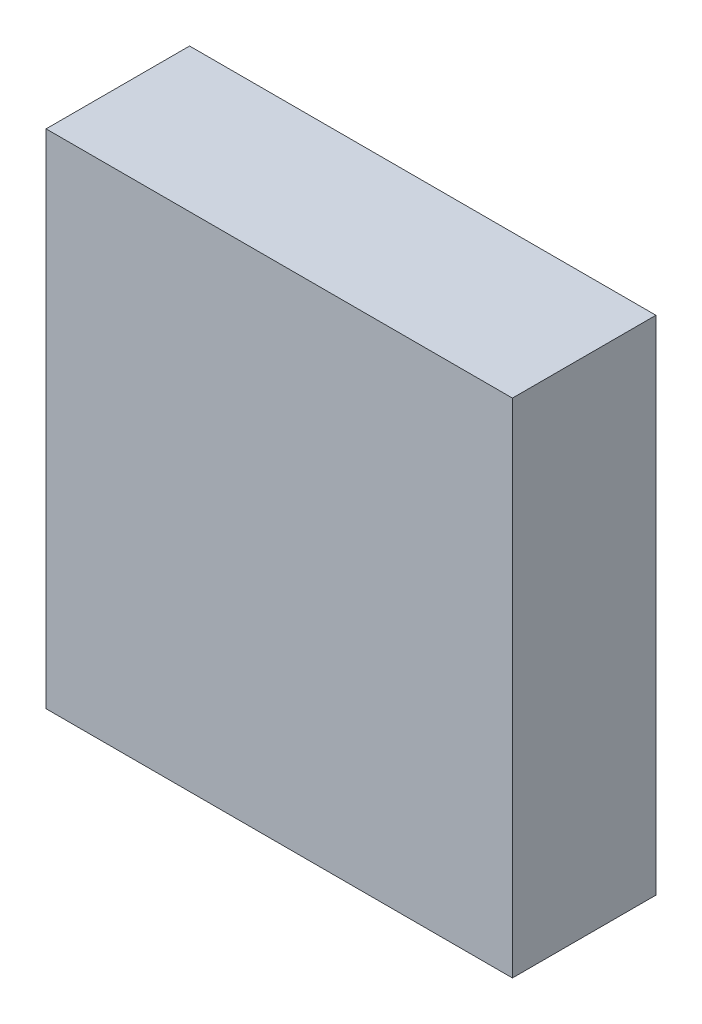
SolidWorks part; units mm, degrees
ref_plane "Ebene vorne" through (0, 0, 0) normal (0, 0, 1) x (1, 0, 0)
ref_plane "Ebene oben" through (0, 0, 0) normal (0, 1, 0) x (1, 0, 0)
ref_plane "Ebene rechts" through (0, 0, 0) normal (1, 0, 0) x (0, 0, -1)
sketch "Skizze1" plane through (0, 0, 0) normal (0, 0, 1) x (1, 0, 0)
  line L1 (0, 0) -> (65, 0)
  line L2 (0, 0) -> (0, 70)
  line L3 (0, 70) -> (65, 70)
  line L4 (65, 0) -> (65, 70)
  dimension "Breite" = 65
  dimension "Höhe" = 70
extrude "Linear austragen1" add sketch "Skizze1" along normal blind 20
